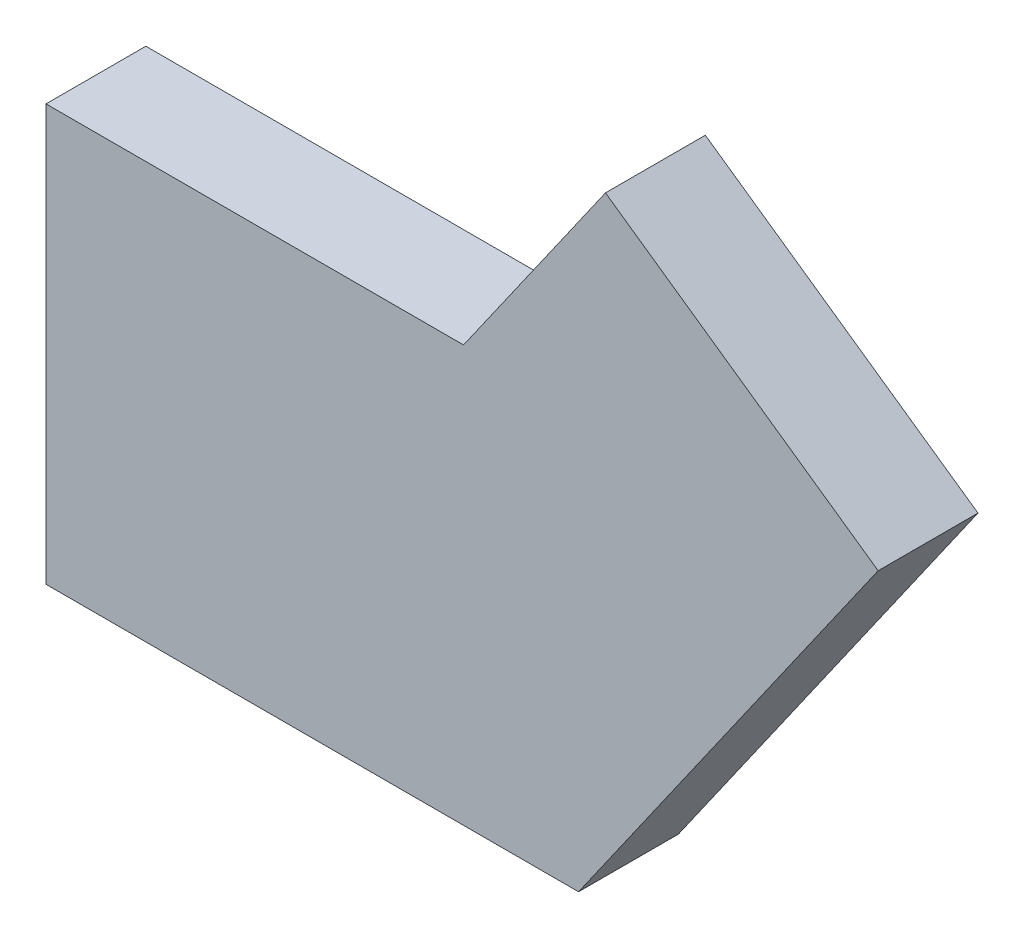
SolidWorks part; units mm, degrees
ref_plane "Front Plane" through (0, 0, 0) normal (0, 0, 1) x (1, 0, 0)
ref_plane "Top Plane" through (0, 0, 0) normal (0, 1, 0) x (1, 0, 0)
ref_plane "Right Plane" through (0, 0, 0) normal (1, 0, 0) x (0, 0, -1)
sketch "Sketch1" plane through (0, 0, 0) normal (0, 0, 1) x (1, 0, 0)
  line L0 (0, 0) -> (32, 0)
  line L1 (32, 0) -> (50, 25.7067)
  line L2 (50, 25.7067) -> (33.617, 37.1782)
  line L3 (33.617, 37.1782) -> (25.0897, 25)
  line L4 (25.0897, 25) -> (0, 25)
  line L5 (0, 25) -> (0, 0)
  dimension "D1" = 20
  dimension "D2" = 32
  dimension "D3" = 50
  dimension "D4" = 25
  dimension "D5" = 125
extrude "Boss-Extrude1" add sketch "Sketch1" along normal blind 6
